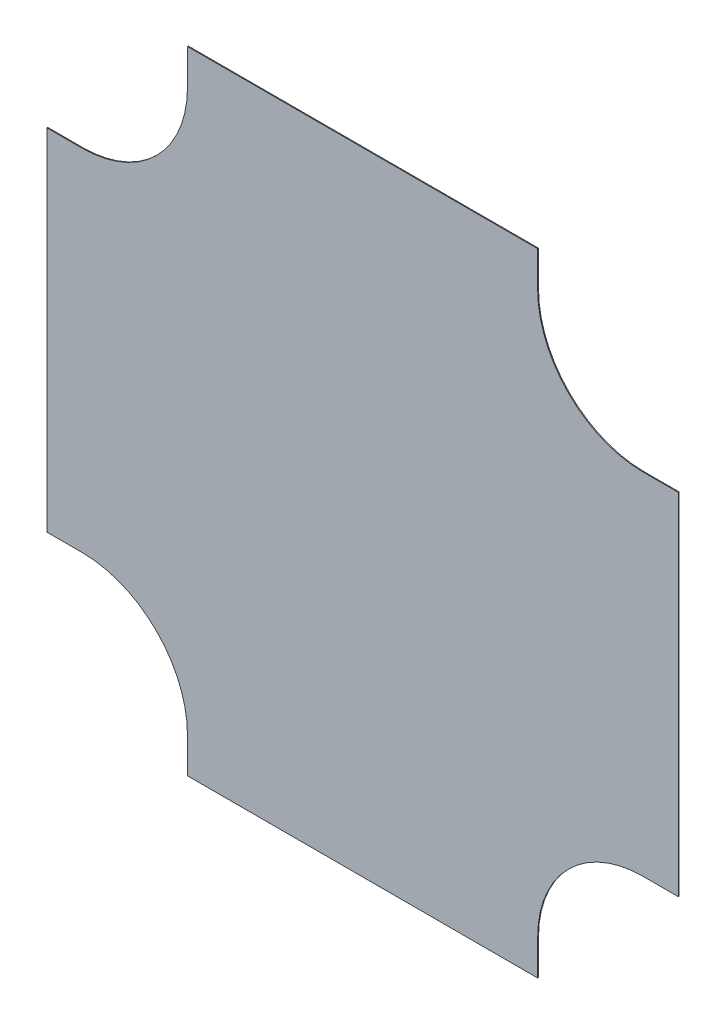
SolidWorks part; units mm, degrees
ref_plane "Front Plane" through (0, 0, 0) normal (0, 0, 1) x (1, 0, 0)
ref_plane "Top Plane" through (0, 0, 0) normal (0, 1, 0) x (1, 0, 0)
ref_plane "Right Plane" through (0, 0, 0) normal (1, 0, 0) x (0, 0, -1)
sketch "Sketch1" plane through (0, 0, 0) normal (0, 0, 1) x (1, 0, 0)
  line L0 (0, 0) -> (497.572, 0)
  line L1 (497.572, 0) -> (497.572, 50)
  line L2 (647.572, 200) -> (697.572, 200)
  line L3 (697.572, 200) -> (697.572, 697.572)
  line L4 (697.572, 697.572) -> (647.572, 697.572)
  line L5 (497.572, 847.572) -> (497.572, 897.572)
  line L6 (497.572, 897.572) -> (0, 897.572)
  line L7 (0, 897.572) -> (0, 847.572)
  line L8 (-150, 697.572) -> (-200, 697.572)
  line L9 (-200, 697.572) -> (-200, 200)
  line L10 (-200, 200) -> (-150, 200)
  line L11 (0, 50) -> (0, 0)
  arc A0 (497.572, 50) -> (647.572, 200) centre (647.572, 50) cw
  arc A1 (647.572, 697.572) -> (497.572, 847.572) centre (647.572, 847.572) cw
  arc A2 (0, 847.572) -> (-150, 697.572) centre (-150, 847.572) cw
  arc A3 (-150, 200) -> (0, 50) centre (-150, 50) cw
  dimension "D3" = 150
  dimension "D1" = 50
  dimension "D2" = 497.572
sheet metal parameters "Sheet-Metal1" thickness 1.2141 parameters "D1"=1.27
base flange "Base-Flange1" sketch "Sketch1" thickness 1.2141 reverse thickness direction yes parameters "D1"=1.27
flat pattern "Flat-Pattern1"
sketch "Bend-Lines1" plane through (0, 0, 0) normal (0, 1, 0) x (-1, 0, 0)
